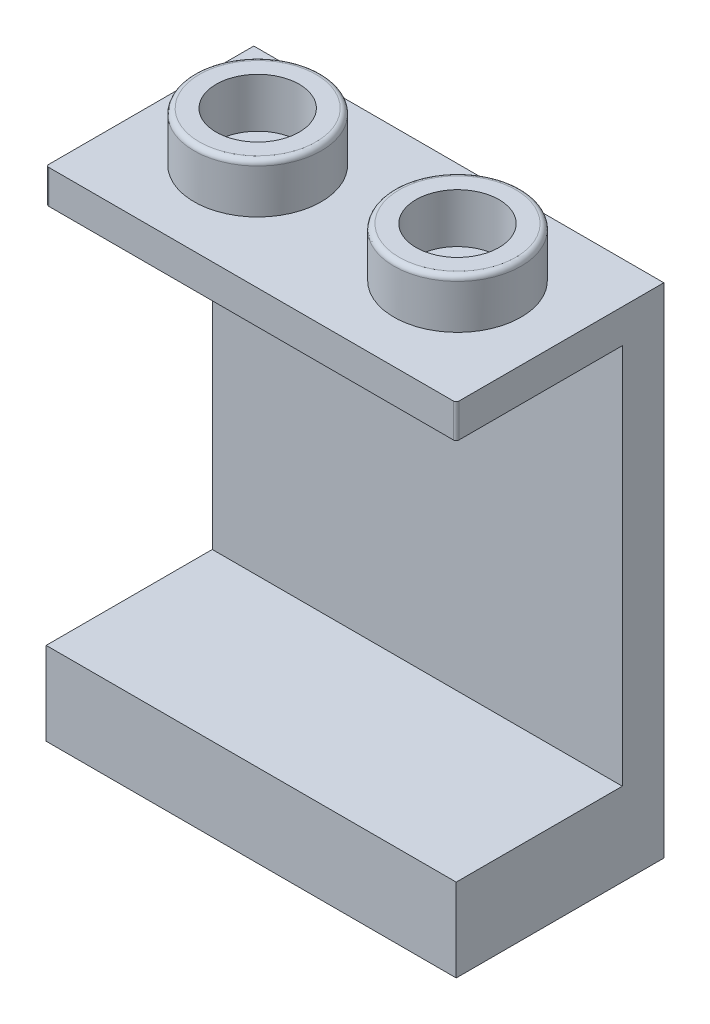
SolidWorks part; units mm, degrees
ref_plane "Vorne" through (0, 0, 0) normal (0, 0, 1) x (1, 0, 0)
ref_plane "Oben" through (0, 0, 0) normal (0, 1, 0) x (1, 0, 0)
ref_plane "Rechts" through (0, 0, 0) normal (1, 0, 0) x (0, 0, -1)
sketch "Skizze1" plane through (0, 0, 0) normal (0, 0, 1) x (1, 0, 0)
  line L1 (0, 0) -> (15.8, 0)
  line L2 (0, 0) -> (0, 19.2)
  line L3 (0, 19.2) -> (15.8, 19.2)
  line L4 (15.8, 0) -> (15.8, 19.2)
  dimension "D1" = 15.8
  dimension "D2" = 19.2
extrude "Linear austragen1" add sketch "Skizze1" along normal blind 8
sketch "Skizze2" plane through (0, 0, 8) normal (0, 0, 1) x (1, 0, 0)
  line L0 (0, 19.2) -> (0, 0) construction
  line L1 (0, 17.9) -> (15.8, 17.9)
  line L2 (0, 17.9) -> (0, 3.2)
  line L3 (0, 3.2) -> (15.8, 3.2)
  line L4 (15.8, 17.9) -> (15.8, 3.2)
  line L5 (15.8, 0) -> (15.8, 19.2) construction
  line L6 (15.8, 19.2) -> (0, 19.2) construction
  line L7 (0, 0) -> (15.8, 0) construction
  dimension "D1" = 1.3
  dimension "D2" = 3.2
extrude "Schnitt-Linear austragen1" cut sketch "Skizze2" against normal blind 6.4
sketch "Skizze3" plane through (0, 19.2, 0) normal (0, 1, 0) x (-1, 0, 0)
  line L1 (-15.8, 0) -> (0, 0) construction
  line L3 (0, 8) -> (0, 0) construction
  line L4 (-1.6, 3.9) -> (-1.6, -0.9591) construction
  line L5 (-14.2, 3.9) -> (-14.2, -0.5237) construction
  line L6 (-15.8, 8) -> (-15.8, 0) construction
  circle A0 centre (-4.05, 3.9) radius 2.45
  circle A1 centre (-4.05, 3.9) radius 1.6
  circle A2 centre (-11.75, 3.9) radius 2.45
  circle A3 centre (-11.75, 3.9) radius 1.6
  dimension "D1" = 3.9
  dimension "D5" = 4.9
  dimension "D6" = 3.2
  dimension "D7" = 4.9
  dimension "D8" = 3.2
  dimension "D2" = 3.9
  dimension "D3" = 1.6
  dimension "D4" = 1.6
extrude "Linear austragen2" add sketch "Skizze3" along normal blind 1.9
fillet "Verrundung1" radius 0.2 2 edges at (4.05, 21.1, 6.35) (11.75, 21.1, 6.35)
sketch "Skizze4" plane through (0, 0, 0) normal (0, -1, 0) x (1, 0, 0)
  line L0 (15.8, 8) -> (15.8, 0) construction
  line L1 (14.2, 6.4) -> (1.6, 6.4)
  line L2 (14.2, 6.4) -> (14.2, 1.6)
  line L3 (14.2, 1.6) -> (1.6, 1.6)
  line L4 (1.6, 6.4) -> (1.6, 1.6)
  line L6 (0, 8) -> (0, 0) construction
  line L7 (0, 8) -> (15.8, 8) construction
  line L8 (0, 0) -> (15.8, 0) construction
  dimension "D1" = 1.6
  dimension "D2" = 1.6
  dimension "D3" = 1.6
  dimension "D4" = 1.6
extrude "Schnitt-Linear austragen2" cut sketch "Skizze4" against normal blind 2.1
fillet "Verrundung2" radius 0.1 1 edges at (15.8, 18.55, 8)
fillet "Verrundung3" radius 0.1 1 edges at (0, 18.55, 8)
sketch "Skizze5" plane through (0, 2.1, 0) normal (0, -1, 0) x (1, 0, 0)
  line L0 (0, 8) -> (15.8, 8) construction
  line L1 (15.8, 8) -> (15.8, 0) construction
  circle A0 centre (7.8, 4) radius 1.55
  circle A1 centre (7.8, 4) radius 0.75
  dimension "D1" = 4
  dimension "D2" = 3.1
  dimension "D4" = 1.5
  dimension "D3" = 8
extrude "Linear austragen3" add sketch "Skizze5" along normal blind 2
fillet "Verrundung4" radius 0.1 1 edges at (7.8, 0.1, 3.25)
